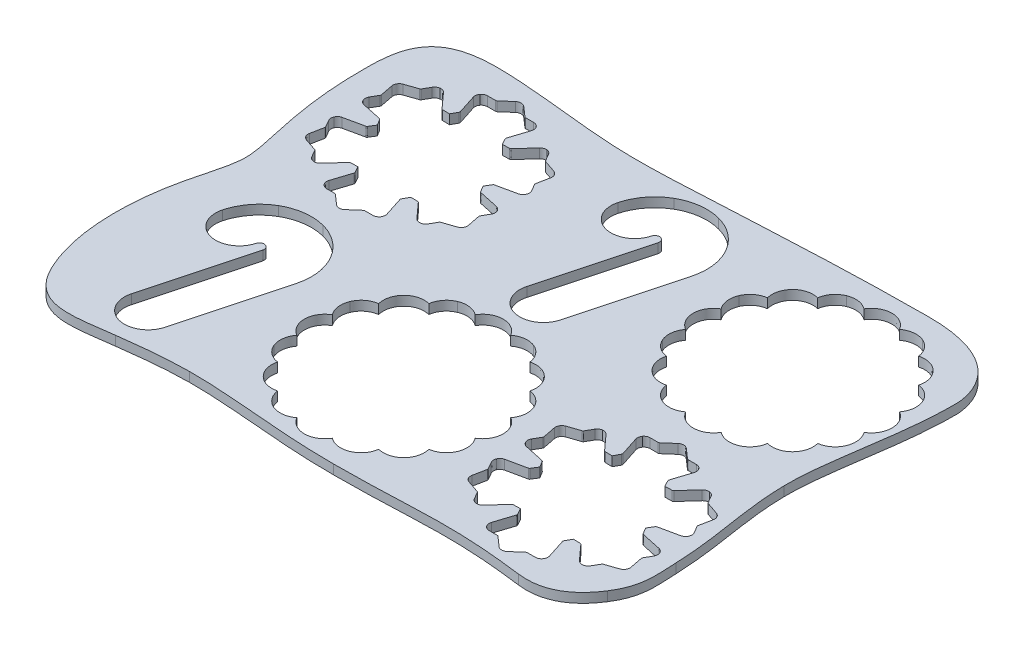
SolidWorks part; units mm, degrees
ref_plane "Front Plane" through (0, 0, 0) normal (0, 0, 1) x (1, 0, 0)
ref_plane "Top Plane" through (0, 0, 0) normal (0, 1, 0) x (1, 0, 0)
ref_plane "Right Plane" through (0, 0, 0) normal (1, 0, 0) x (0, 0, -1)
sketch "Sketch1" plane through (0, 0, 0) normal (0, 1, 0) x (1, 0, 0)
  line L100 (-5.4526, -78.2747) -> (-4.2948, -80.1766)
  line L101 (-3.9727, -80.4056) -> (2.2196, -81.7357)
  line L102 (3.5316, -84.6911) -> (2.2506, -86.9098)
  line L103 (2.1932, -87.2568) -> (2.9936, -91.3045)
  line L104 (1.6767, -93.5857) -> (-2.229, -94.9164)
  line L105 (-2.5008, -95.1396) -> (-3.7818, -97.3583)
  line L106 (-6.9972, -97.6996) -> (-11.2454, -93.0021)
  line L107 (-11.6046, -92.8376) -> (-13.8307, -92.7859)
  line L108 (-13.8307, -92.7859) -> (-14.8989, -94.7395)
  line L109 (-14.9361, -95.1329) -> (-12.9919, -101.1607)
  line L110 (-14.8953, -103.7747) -> (-17.4572, -103.7747)
  line L111 (-17.7865, -103.8984) -> (-20.8917, -106.6155)
  line L112 (-23.5257, -106.6155) -> (-26.6309, -103.8984)
  line L113 (-26.9602, -103.7747) -> (-29.5221, -103.7747)
  line L114 (-31.4255, -101.1607) -> (-29.4813, -95.1329)
  line L115 (-29.5185, -94.7395) -> (-30.5867, -92.7859)
  line L116 (-30.5867, -92.7859) -> (-32.8128, -92.8376)
  line L117 (-33.172, -93.0021) -> (-37.4202, -97.6996)
  line L118 (-40.6356, -97.3583) -> (-41.9166, -95.1396)
  line L119 (-42.1884, -94.9164) -> (-46.0941, -93.5857)
  line L120 (-47.411, -91.3045) -> (-46.6106, -87.2568)
  line L121 (-46.668, -86.9098) -> (-47.949, -84.6911)
  line L122 (-46.637, -81.7357) -> (-40.4447, -80.4056)
  line L123 (-40.1226, -80.1766) -> (-38.9648, -78.2747)
  line L124 (-38.9648, -78.2747) -> (-40.1226, -76.3728)
  line L125 (-40.4447, -76.1438) -> (-46.637, -74.8137)
  line L126 (-47.949, -71.8583) -> (-46.668, -69.6396)
  line L127 (-46.6106, -69.2926) -> (-47.411, -65.2449)
  line L128 (-46.0941, -62.9637) -> (-42.1884, -61.633)
  line L129 (-41.9166, -61.4098) -> (-40.6356, -59.1911)
  line L130 (-37.4202, -58.8498) -> (-33.172, -63.5473)
  line L131 (-32.8128, -63.7118) -> (-30.5867, -63.7635)
  line L132 (-30.5867, -63.7635) -> (-29.5185, -61.8099)
  line L133 (-29.4813, -61.4165) -> (-31.4255, -55.3887)
  line L134 (-29.5221, -52.7747) -> (-26.9602, -52.7747)
  line L135 (-26.6309, -52.651) -> (-23.5257, -49.9339)
  line L136 (-20.8917, -49.9339) -> (-17.7865, -52.651)
  line L137 (-17.4572, -52.7747) -> (-14.8953, -52.7747)
  line L138 (-12.9919, -55.3887) -> (-14.9361, -61.4165)
  line L139 (-14.8989, -61.8099) -> (-13.8307, -63.7635)
  line L140 (-13.8307, -63.7635) -> (-11.6046, -63.7118)
  line L141 (-11.2454, -63.5473) -> (-6.9972, -58.8498)
  line L142 (-3.7818, -59.1911) -> (-2.5008, -61.4098)
  line L143 (-2.229, -61.633) -> (1.6767, -62.9637)
  line L144 (2.9936, -65.2449) -> (2.1932, -69.2926)
  line L145 (2.2506, -69.6396) -> (3.5316, -71.8583)
  line L146 (2.2196, -74.8137) -> (-3.9727, -76.1438)
  line L147 (-4.2948, -76.3728) -> (-5.4526, -78.2747)
  line L148 (114.1494, -146.3616) -> (115.3072, -148.2635)
  line L149 (115.6293, -148.4925) -> (121.8216, -149.8226)
  line L150 (123.1336, -152.778) -> (121.8526, -154.9967)
  line L151 (121.7952, -155.3437) -> (122.5956, -159.3914)
  line L152 (121.2787, -161.6726) -> (117.373, -163.0033)
  line L153 (117.1012, -163.2265) -> (115.8202, -165.4452)
  line L154 (112.6048, -165.7865) -> (108.3566, -161.089)
  line L155 (107.9974, -160.9245) -> (105.7713, -160.8728)
  line L156 (105.7713, -160.8728) -> (104.7031, -162.8264)
  line L157 (104.6659, -163.2198) -> (106.6101, -169.2476)
  line L158 (104.7067, -171.8616) -> (102.1448, -171.8616)
  line L159 (101.8155, -171.9853) -> (98.7103, -174.7024)
  line L160 (96.0763, -174.7024) -> (92.9711, -171.9853)
  line L161 (92.6418, -171.8616) -> (90.0799, -171.8616)
  line L162 (88.1765, -169.2476) -> (90.1207, -163.2198)
  line L163 (90.0835, -162.8264) -> (89.0153, -160.8728)
  line L164 (89.0153, -160.8728) -> (86.7892, -160.9245)
  line L165 (86.43, -161.089) -> (82.1818, -165.7865)
  line L166 (78.9664, -165.4452) -> (77.6854, -163.2265)
  line L167 (77.4136, -163.0033) -> (73.5079, -161.6726)
  line L168 (72.191, -159.3914) -> (72.9914, -155.3437)
  line L169 (72.934, -154.9967) -> (71.653, -152.778)
  line L170 (72.965, -149.8226) -> (79.1573, -148.4925)
  line L171 (79.4794, -148.2635) -> (80.6372, -146.3616)
  line L172 (80.6372, -146.3616) -> (79.4794, -144.4597)
  line L173 (79.1573, -144.2307) -> (72.965, -142.9006)
  line L174 (71.653, -139.9452) -> (72.934, -137.7265)
  line L175 (72.9914, -137.3795) -> (72.191, -133.3318)
  line L176 (73.5079, -131.0506) -> (77.4136, -129.7199)
  line L177 (77.6854, -129.4967) -> (78.9664, -127.278)
  line L178 (82.1818, -126.9367) -> (86.43, -131.6342)
  line L179 (86.7892, -131.7987) -> (89.0153, -131.8504)
  line L180 (89.0153, -131.8504) -> (90.0835, -129.8968)
  line L181 (90.1207, -129.5034) -> (88.1765, -123.4756)
  line L182 (90.0799, -120.8616) -> (92.6418, -120.8616)
  line L183 (92.9711, -120.7379) -> (96.0763, -118.0208)
  line L184 (98.7103, -118.0208) -> (101.8155, -120.7379)
  line L185 (102.1448, -120.8616) -> (104.7067, -120.8616)
  line L186 (106.6101, -123.4756) -> (104.6659, -129.5034)
  line L187 (104.7031, -129.8968) -> (105.7713, -131.8504)
  line L188 (105.7713, -131.8504) -> (107.9974, -131.7987)
  line L189 (108.3566, -131.6342) -> (112.6048, -126.9367)
  line L190 (115.8202, -127.278) -> (117.1012, -129.4967)
  line L191 (117.373, -129.7199) -> (121.2787, -131.0506)
  line L192 (122.5956, -133.3318) -> (121.7952, -137.3795)
  line L193 (121.8526, -137.7265) -> (123.1336, -139.9452)
  line L194 (121.8216, -142.9006) -> (115.6293, -144.2307)
  line L195 (115.3072, -144.4597) -> (114.1494, -146.3616)
  line L196 (52.319, -69.9423) -> (43.5191, -102.7837)
  line L197 (29.0302, -98.9015) -> (37.83, -66.06)
  line L198 (-8.328, -134.6046) -> (-17.1279, -167.446)
  line L199 (-31.6168, -163.5638) -> (-22.817, -130.7223)
  spline S0 degree 3 poles (10.2066, -46.725) (-4.1601, -46.725) (-21.8076, -43.4442) (-36.1743, -43.4442) knots 0.933333 0.933333 0.933333 0.933333 1 1 1 1
  spline S1 degree 3 poles (100.8566, -43.5364) (61.0797, -43.6655) (27.679, -46.9673) (10.2066, -46.725) knots 0.866667 0.866667 0.866667 0.866667 0.933333 0.933333 0.933333 0.933333
  spline S2 degree 3 poles (124.4948, -112.8693) (124.2114, -99.3196) (129.2574, -80.9721) (129.2574, -63.3776) (129.2574, -61.7415) (129.2574, -43.4443) (100.8566, -43.5364) knots 0.733333 0.733333 0.733333 0.733333 0.8 0.8 0.8 0.866667 0.866667 0.866667 0.866667
  spline S3 degree 3 poles (128.5409, -151.0747) (127.8277, -135.2704) (124.7905, -127.0117) (124.4948, -112.8693) knots 0.666667 0.666667 0.666667 0.666667 0.733333 0.733333 0.733333 0.733333
  spline S4 degree 3 poles (125.3709, -169.6066) (129.4875, -163.2087) (128.8669, -158.303) (128.5409, -151.0747) knots 0.6 0.6 0.6 0.6 0.666667 0.666667 0.666667 0.666667
  spline S5 degree 3 poles (106.5724, -179.1324) (116.5716, -180.4333) (122.2318, -174.4851) (125.3709, -169.6066) knots 0.533333 0.533333 0.533333 0.533333 0.6 0.6 0.6 0.6
  spline S6 degree 3 poles (47.1667, -178.2283) (73.1303, -178.1855) (80.9016, -175.7924) (106.5724, -179.1324) knots 0.466667 0.466667 0.466667 0.466667 0.533333 0.533333 0.533333 0.533333
  spline S7 degree 3 poles (-1.0433, -175.6612) (12.98, -175.5302) (28.1615, -178.2596) (47.1667, -178.2283) knots 0.4 0.4 0.4 0.4 0.466667 0.466667 0.466667 0.466667
  spline S8 degree 3 poles (-22.7994, -177.4606) (-16.2998, -176.6473) (-9.5271, -175.7405) (-1.0433, -175.6612) knots 0.333333 0.333333 0.333333 0.333333 0.4 0.4 0.4 0.4
  spline S9 degree 3 poles (-51.6012, -168.625) (-45.3179, -182.1062) (-34.9935, -178.9865) (-22.7994, -177.4606) knots 0.266667 0.266667 0.266667 0.266667 0.333333 0.333333 0.333333 0.333333
  spline S10 degree 3 poles (-54.2266, -124.1699) (-57.4788, -138.2379) (-57.7685, -155.3929) (-51.6012, -168.625) knots 0.2 0.2 0.2 0.2 0.266667 0.266667 0.266667 0.266667
  spline S11 degree 3 poles (-50.9684, -109.4932) (-51.4044, -114.2106) (-52.7481, -117.7745) (-54.2266, -124.1699) knots 0.133333 0.133333 0.133333 0.133333 0.2 0.2 0.2 0.2
  spline S12 degree 3 poles (-56.4426, -63.5892) (-56.7369, -89.5125) (-50.1871, -101.0414) (-50.9684, -109.4932) knots 0.066667 0.066667 0.066667 0.066667 0.133333 0.133333 0.133333 0.133333
  spline S13 degree 3 poles (-36.1743, -43.4442) (-53.4737, -43.4442) (-56.3096, -51.8729) (-56.4426, -63.5892) knots 0 0 0 0 0.066667 0.066667 0.066667 0.066667
  spline S250 degree 3 poles (-4.2948, -80.1766) (-4.2771, -80.2056) (-4.2355, -80.2604) (-4.1593, -80.327) (-4.0713, -80.3772) (-4.0059, -80.3984) (-3.9727, -80.4056) knots 0.009804 0.009804 0.009804 0.009804 0.012255 0.014705 0.017156 0.019607 0.019607 0.019607 0.019607
  spline S251 degree 3 poles (2.2196, -81.7357) (2.3737, -81.7688) (2.6768, -81.873) (3.0721, -82.1251) (3.3997, -82.4604) (3.5636, -82.7357) (3.6276, -82.8797) knots 0.029412 0.029412 0.029412 0.029412 0.031863 0.034314 0.036765 0.039216 0.039216 0.039216 0.039216
  spline S252 degree 3 poles (3.6276, -82.8797) (3.6915, -83.0237) (3.7853, -83.33) (3.8138, -83.7978) (3.736, -84.2599) (3.6104, -84.5547) (3.5316, -84.6911) knots 0.039216 0.039216 0.039216 0.039216 0.041666 0.044117 0.046568 0.049019 0.049019 0.049019 0.049019
  spline S253 degree 3 poles (2.2506, -86.9098) (2.2357, -86.9357) (2.2105, -86.9903) (2.1879, -87.0777) (2.1811, -87.1677) (2.1874, -87.2275) (2.1932, -87.2568) knots 0.058824 0.058824 0.058824 0.058824 0.061275 0.063726 0.066177 0.068628 0.068628 0.068628 0.068628
  spline S254 degree 3 poles (2.9936, -91.3045) (3.0405, -91.5418) (3.0452, -92.0445) (2.7975, -92.712) (2.3434, -93.2603) (1.9056, -93.5077) (1.6767, -93.5857) knots 0.078431 0.078431 0.078431 0.078431 0.080882 0.083333 0.085784 0.088235 0.088235 0.088235 0.088235
  spline S255 degree 3 poles (-2.229, -94.9164) (-2.2574, -94.9261) (-2.3128, -94.9507) (-2.3869, -95.0013) (-2.4509, -95.0641) (-2.4858, -95.1136) (-2.5008, -95.1396) knots 0.098039 0.098039 0.098039 0.098039 0.10049 0.102941 0.105392 0.107843 0.107843 0.107843 0.107843
  spline S256 degree 3 poles (-3.7818, -97.3583) (-3.8606, -97.4948) (-4.0528, -97.7513) (-4.414, -98.0501) (-4.8337, -98.259) (-5.1462, -98.3305) (-5.3029, -98.3471) knots 0.117647 0.117647 0.117647 0.117647 0.120098 0.122549 0.125 0.127451 0.127451 0.127451 0.127451
  spline S257 degree 3 poles (-5.3029, -98.3471) (-5.4596, -98.3637) (-5.78, -98.3593) (-6.234, -98.2431) (-6.6498, -98.0269) (-6.8915, -97.8165) (-6.9972, -97.6996) knots 0.127451 0.127451 0.127451 0.127451 0.129902 0.132353 0.134804 0.137255 0.137255 0.137255 0.137255
  spline S258 degree 3 poles (-11.2454, -93.0021) (-11.2681, -92.9769) (-11.3192, -92.9309) (-11.4066, -92.8798) (-11.5025, -92.847) (-11.5707, -92.8384) (-11.6046, -92.8376) knots 0.147059 0.147059 0.147059 0.147059 0.14951 0.15196 0.154411 0.156862 0.156862 0.156862 0.156862
  spline S259 degree 3 poles (-14.8989, -94.7395) (-14.9151, -94.7693) (-14.9417, -94.8327) (-14.9613, -94.9323) (-14.9608, -95.0337) (-14.9465, -95.1007) (-14.9361, -95.1329) knots 0.176472 0.176472 0.176472 0.176472 0.178922 0.181373 0.183824 0.186274 0.186274 0.186274 0.186274
  spline S260 degree 3 poles (-12.9919, -101.1607) (-12.9436, -101.3107) (-12.8824, -101.6252) (-12.9032, -102.0933) (-13.0295, -102.5447) (-13.1857, -102.8245) (-13.2785, -102.9519) knots 0.196078 0.196078 0.196078 0.196078 0.198529 0.20098 0.203431 0.205882 0.205882 0.205882 0.205882
  spline S261 degree 3 poles (-13.2785, -102.9519) (-13.3712, -103.0793) (-13.5894, -103.3141) (-13.9801, -103.5731) (-14.4195, -103.7365) (-14.7377, -103.7747) (-14.8953, -103.7747) knots 0.205883 0.205883 0.205883 0.205883 0.208333 0.210784 0.213235 0.215686 0.215686 0.215686 0.215686
  spline S262 degree 3 poles (-17.4572, -103.7747) (-17.4872, -103.7747) (-17.5476, -103.7802) (-17.634, -103.8042) (-17.7148, -103.843) (-17.7639, -103.8786) (-17.7865, -103.8984) knots 0.22549 0.22549 0.22549 0.22549 0.227941 0.230392 0.232843 0.235294 0.235294 0.235294 0.235294
  spline S263 degree 3 poles (-20.8917, -106.6155) (-21.0737, -106.7748) (-21.5067, -107.0306) (-22.2087, -107.1501) (-22.9107, -107.0306) (-23.3437, -106.7748) (-23.5257, -106.6155) knots 0.245098 0.245098 0.245098 0.245098 0.247549 0.25 0.252451 0.254902 0.254902 0.254902 0.254902
  spline S264 degree 3 poles (-26.6309, -103.8984) (-26.6535, -103.8786) (-26.7026, -103.843) (-26.7834, -103.8042) (-26.8698, -103.7802) (-26.9302, -103.7747) (-26.9602, -103.7747) knots 0.264706 0.264706 0.264706 0.264706 0.267157 0.269608 0.272059 0.27451 0.27451 0.27451 0.27451
  spline S265 degree 3 poles (-29.5221, -103.7747) (-29.6797, -103.7747) (-29.9979, -103.7365) (-30.4373, -103.5731) (-30.828, -103.3141) (-31.0462, -103.0793) (-31.1389, -102.9519) knots 0.284314 0.284314 0.284314 0.284314 0.286765 0.289216 0.291667 0.294117 0.294117 0.294117 0.294117
  spline S266 degree 3 poles (-31.1389, -102.9519) (-31.2317, -102.8245) (-31.3879, -102.5447) (-31.5142, -102.0933) (-31.535, -101.6252) (-31.4738, -101.3107) (-31.4255, -101.1607) knots 0.294118 0.294118 0.294118 0.294118 0.296569 0.29902 0.301471 0.303922 0.303922 0.303922 0.303922
  spline S267 degree 3 poles (-29.4813, -95.1329) (-29.4709, -95.1007) (-29.4566, -95.0337) (-29.4561, -94.9323) (-29.4757, -94.8327) (-29.5023, -94.7693) (-29.5185, -94.7395) knots 0.313726 0.313726 0.313726 0.313726 0.316176 0.318627 0.321078 0.323528 0.323528 0.323528 0.323528
  spline S268 degree 3 poles (-32.8128, -92.8376) (-32.8467, -92.8384) (-32.9149, -92.847) (-33.0108, -92.8798) (-33.0982, -92.9309) (-33.1493, -92.9769) (-33.172, -93.0021) knots 0.343138 0.343138 0.343138 0.343138 0.345589 0.34804 0.35049 0.352941 0.352941 0.352941 0.352941
  spline S269 degree 3 poles (-37.4202, -97.6996) (-37.5259, -97.8165) (-37.7676, -98.0269) (-38.1834, -98.2431) (-38.6374, -98.3593) (-38.9578, -98.3637) (-39.1145, -98.3471) knots 0.362745 0.362745 0.362745 0.362745 0.365196 0.367647 0.370098 0.372549 0.372549 0.372549 0.372549
  spline S270 degree 3 poles (-39.1145, -98.3471) (-39.2712, -98.3305) (-39.5837, -98.259) (-40.0034, -98.0501) (-40.3646, -97.7513) (-40.5568, -97.4948) (-40.6356, -97.3583) knots 0.372549 0.372549 0.372549 0.372549 0.375 0.377451 0.379902 0.382353 0.382353 0.382353 0.382353
  spline S271 degree 3 poles (-41.9166, -95.1396) (-41.9316, -95.1136) (-41.9665, -95.0641) (-42.0305, -95.0013) (-42.1046, -94.9507) (-42.16, -94.9261) (-42.1884, -94.9164) knots 0.392157 0.392157 0.392157 0.392157 0.394608 0.397059 0.39951 0.401961 0.401961 0.401961 0.401961
  spline S272 degree 3 poles (-46.0941, -93.5857) (-46.323, -93.5077) (-46.7608, -93.2603) (-47.2149, -92.712) (-47.4626, -92.0445) (-47.4579, -91.5418) (-47.411, -91.3045) knots 0.411765 0.411765 0.411765 0.411765 0.414216 0.416667 0.419118 0.421569 0.421569 0.421569 0.421569
  spline S273 degree 3 poles (-46.6106, -87.2568) (-46.6048, -87.2275) (-46.5985, -87.1677) (-46.6053, -87.0777) (-46.6279, -86.9903) (-46.6531, -86.9357) (-46.668, -86.9098) knots 0.431372 0.431372 0.431372 0.431372 0.433823 0.436274 0.438725 0.441176 0.441176 0.441176 0.441176
  spline S274 degree 3 poles (-47.949, -84.6911) (-48.0278, -84.5547) (-48.1534, -84.26) (-48.2312, -83.7979) (-48.2027, -83.3302) (-48.109, -83.0239) (-48.0451, -82.8799) knots 0.45098 0.45098 0.45098 0.45098 0.453431 0.455883 0.458334 0.460785 0.460785 0.460785 0.460785
  spline S275 degree 3 poles (-48.0451, -82.8799) (-47.9812, -82.7358) (-47.8172, -82.4605) (-47.4896, -82.1251) (-47.0943, -81.873) (-46.7911, -81.7688) (-46.637, -81.7357) knots 0.460784 0.460784 0.460784 0.460784 0.463235 0.465686 0.468137 0.470588 0.470588 0.470588 0.470588
  spline S276 degree 3 poles (-40.4447, -80.4056) (-40.4115, -80.3984) (-40.3461, -80.3772) (-40.2581, -80.327) (-40.1819, -80.2604) (-40.1403, -80.2056) (-40.1226, -80.1766) knots 0.480393 0.480393 0.480393 0.480393 0.482844 0.485295 0.487745 0.490196 0.490196 0.490196 0.490196
  spline S277 degree 3 poles (-40.1226, -76.3728) (-40.1403, -76.3438) (-40.1819, -76.289) (-40.2581, -76.2224) (-40.3461, -76.1722) (-40.4115, -76.151) (-40.4447, -76.1438) knots 0.509804 0.509804 0.509804 0.509804 0.512255 0.514705 0.517156 0.519607 0.519607 0.519607 0.519607
  spline S278 degree 3 poles (-46.637, -74.8137) (-46.7911, -74.7806) (-47.0943, -74.6764) (-47.4896, -74.4243) (-47.8172, -74.0889) (-47.9812, -73.8136) (-48.0451, -73.6695) knots 0.529412 0.529412 0.529412 0.529412 0.531863 0.534314 0.536765 0.539216 0.539216 0.539216 0.539216
  spline S279 degree 3 poles (-48.0451, -73.6695) (-48.109, -73.5255) (-48.2027, -73.2192) (-48.2312, -72.7515) (-48.1534, -72.2894) (-48.0278, -71.9947) (-47.949, -71.8583) knots 0.539215 0.539215 0.539215 0.539215 0.541666 0.544117 0.546569 0.54902 0.54902 0.54902 0.54902
  spline S280 degree 3 poles (-46.668, -69.6396) (-46.6531, -69.6137) (-46.6279, -69.5591) (-46.6053, -69.4717) (-46.5985, -69.3817) (-46.6048, -69.3219) (-46.6106, -69.2926) knots 0.558824 0.558824 0.558824 0.558824 0.561275 0.563726 0.566177 0.568628 0.568628 0.568628 0.568628
  spline S281 degree 3 poles (-47.411, -65.2449) (-47.4579, -65.0076) (-47.4626, -64.5049) (-47.2149, -63.8374) (-46.7608, -63.2891) (-46.323, -63.0417) (-46.0941, -62.9637) knots 0.578431 0.578431 0.578431 0.578431 0.580882 0.583333 0.585784 0.588235 0.588235 0.588235 0.588235
  spline S282 degree 3 poles (-42.1884, -61.633) (-42.16, -61.6233) (-42.1046, -61.5987) (-42.0305, -61.5481) (-41.9665, -61.4853) (-41.9316, -61.4358) (-41.9166, -61.4098) knots 0.598039 0.598039 0.598039 0.598039 0.60049 0.602941 0.605392 0.607843 0.607843 0.607843 0.607843
  spline S283 degree 3 poles (-40.6356, -59.1911) (-40.5568, -59.0546) (-40.3646, -58.7981) (-40.0034, -58.4993) (-39.5837, -58.2904) (-39.2712, -58.2189) (-39.1145, -58.2023) knots 0.617647 0.617647 0.617647 0.617647 0.620098 0.622549 0.625 0.627451 0.627451 0.627451 0.627451
  spline S284 degree 3 poles (-39.1145, -58.2023) (-38.9578, -58.1857) (-38.6374, -58.1901) (-38.1834, -58.3063) (-37.7676, -58.5225) (-37.5259, -58.7329) (-37.4202, -58.8498) knots 0.627451 0.627451 0.627451 0.627451 0.629902 0.632353 0.634804 0.637255 0.637255 0.637255 0.637255
  spline S285 degree 3 poles (-33.172, -63.5473) (-33.1493, -63.5725) (-33.0982, -63.6185) (-33.0108, -63.6696) (-32.9149, -63.7024) (-32.8467, -63.711) (-32.8128, -63.7118) knots 0.647059 0.647059 0.647059 0.647059 0.64951 0.65196 0.654411 0.656862 0.656862 0.656862 0.656862
  spline S286 degree 3 poles (-29.5185, -61.8099) (-29.5023, -61.7801) (-29.4757, -61.7167) (-29.4561, -61.6171) (-29.4566, -61.5157) (-29.4709, -61.4487) (-29.4813, -61.4165) knots 0.676472 0.676472 0.676472 0.676472 0.678922 0.681373 0.683824 0.686274 0.686274 0.686274 0.686274
  spline S287 degree 3 poles (-31.4255, -55.3887) (-31.4738, -55.2387) (-31.535, -54.9242) (-31.5142, -54.4561) (-31.3879, -54.0047) (-31.2317, -53.7249) (-31.1389, -53.5975) knots 0.696078 0.696078 0.696078 0.696078 0.698529 0.70098 0.703431 0.705882 0.705882 0.705882 0.705882
  spline S288 degree 3 poles (-31.1389, -53.5975) (-31.0462, -53.4701) (-30.828, -53.2353) (-30.4373, -52.9763) (-29.9979, -52.8129) (-29.6797, -52.7747) (-29.5221, -52.7747) knots 0.705883 0.705883 0.705883 0.705883 0.708333 0.710784 0.713235 0.715686 0.715686 0.715686 0.715686
  spline S289 degree 3 poles (-26.9602, -52.7747) (-26.9302, -52.7747) (-26.8698, -52.7692) (-26.7834, -52.7452) (-26.7026, -52.7064) (-26.6535, -52.6708) (-26.6309, -52.651) knots 0.72549 0.72549 0.72549 0.72549 0.727941 0.730392 0.732843 0.735294 0.735294 0.735294 0.735294
  spline S290 degree 3 poles (-23.5257, -49.9339) (-23.3437, -49.7746) (-22.9107, -49.5188) (-22.2087, -49.3993) (-21.5067, -49.5188) (-21.0737, -49.7746) (-20.8917, -49.9339) knots 0.745098 0.745098 0.745098 0.745098 0.747549 0.75 0.752451 0.754902 0.754902 0.754902 0.754902
  spline S291 degree 3 poles (-17.7865, -52.651) (-17.7639, -52.6708) (-17.7148, -52.7064) (-17.634, -52.7452) (-17.5476, -52.7692) (-17.4872, -52.7747) (-17.4572, -52.7747) knots 0.764706 0.764706 0.764706 0.764706 0.767157 0.769608 0.772059 0.77451 0.77451 0.77451 0.77451
  spline S292 degree 3 poles (-14.8953, -52.7747) (-14.7377, -52.7747) (-14.4195, -52.8129) (-13.9801, -52.9763) (-13.5894, -53.2353) (-13.3712, -53.4701) (-13.2785, -53.5975) knots 0.784314 0.784314 0.784314 0.784314 0.786765 0.789216 0.791667 0.794117 0.794117 0.794117 0.794117
  spline S293 degree 3 poles (-13.2785, -53.5975) (-13.1857, -53.7249) (-13.0295, -54.0047) (-12.9032, -54.4561) (-12.8824, -54.9242) (-12.9436, -55.2387) (-12.9919, -55.3887) knots 0.794118 0.794118 0.794118 0.794118 0.796569 0.79902 0.801471 0.803922 0.803922 0.803922 0.803922
  spline S294 degree 3 poles (-14.9361, -61.4165) (-14.9465, -61.4487) (-14.9608, -61.5157) (-14.9613, -61.6171) (-14.9417, -61.7167) (-14.9151, -61.7801) (-14.8989, -61.8099) knots 0.813726 0.813726 0.813726 0.813726 0.816176 0.818627 0.821078 0.823528 0.823528 0.823528 0.823528
  spline S295 degree 3 poles (-11.6046, -63.7118) (-11.5707, -63.711) (-11.5025, -63.7024) (-11.4066, -63.6696) (-11.3192, -63.6185) (-11.2681, -63.5725) (-11.2454, -63.5473) knots 0.843138 0.843138 0.843138 0.843138 0.845589 0.84804 0.85049 0.852941 0.852941 0.852941 0.852941
  spline S296 degree 3 poles (-6.9972, -58.8498) (-6.8915, -58.7329) (-6.6498, -58.5225) (-6.234, -58.3063) (-5.78, -58.1901) (-5.4596, -58.1857) (-5.3029, -58.2023) knots 0.862745 0.862745 0.862745 0.862745 0.865196 0.867647 0.870098 0.872549 0.872549 0.872549 0.872549
  spline S297 degree 3 poles (-5.3029, -58.2023) (-5.1462, -58.2189) (-4.8337, -58.2904) (-4.414, -58.4993) (-4.0528, -58.7981) (-3.8606, -59.0546) (-3.7818, -59.1911) knots 0.872549 0.872549 0.872549 0.872549 0.875 0.877451 0.879902 0.882353 0.882353 0.882353 0.882353
  spline S298 degree 3 poles (-2.5008, -61.4098) (-2.4858, -61.4358) (-2.4509, -61.4853) (-2.3869, -61.5481) (-2.3128, -61.5987) (-2.2574, -61.6233) (-2.229, -61.633) knots 0.892157 0.892157 0.892157 0.892157 0.894608 0.897059 0.89951 0.901961 0.901961 0.901961 0.901961
  spline S299 degree 3 poles (1.6767, -62.9637) (1.9056, -63.0417) (2.3434, -63.2891) (2.7975, -63.8374) (3.0452, -64.5049) (3.0405, -65.0076) (2.9936, -65.2449) knots 0.911765 0.911765 0.911765 0.911765 0.914216 0.916667 0.919118 0.921569 0.921569 0.921569 0.921569
  spline S300 degree 3 poles (2.1932, -69.2926) (2.1874, -69.3219) (2.1811, -69.3817) (2.1879, -69.4717) (2.2105, -69.5591) (2.2357, -69.6137) (2.2506, -69.6396) knots 0.931372 0.931372 0.931372 0.931372 0.933823 0.936274 0.938725 0.941176 0.941176 0.941176 0.941176
  spline S301 degree 3 poles (3.5316, -71.8583) (3.6104, -71.9947) (3.736, -72.2894) (3.8138, -72.7515) (3.7853, -73.2192) (3.6916, -73.5255) (3.6277, -73.6695) knots 0.95098 0.95098 0.95098 0.95098 0.953431 0.955883 0.958334 0.960785 0.960785 0.960785 0.960785
  spline S302 degree 3 poles (3.6277, -73.6695) (3.5638, -73.8136) (3.3998, -74.0889) (3.0722, -74.4243) (2.6769, -74.6764) (2.3737, -74.7806) (2.2196, -74.8137) knots 0.960784 0.960784 0.960784 0.960784 0.963235 0.965686 0.968137 0.970588 0.970588 0.970588 0.970588
  spline S303 degree 3 poles (-3.9727, -76.1438) (-4.0059, -76.151) (-4.0713, -76.1722) (-4.1593, -76.2224) (-4.2355, -76.289) (-4.2771, -76.3438) (-4.2948, -76.3728) knots 0.980393 0.980393 0.980393 0.980393 0.982844 0.985295 0.987745 0.990196 0.990196 0.990196 0.990196
  spline S358 degree 3 poles (115.3072, -148.2635) (115.3249, -148.2925) (115.3665, -148.3473) (115.4427, -148.4139) (115.5307, -148.4641) (115.5961, -148.4853) (115.6293, -148.4925) knots 0.009804 0.009804 0.009804 0.009804 0.012255 0.014705 0.017156 0.019607 0.019607 0.019607 0.019607
  spline S359 degree 3 poles (121.8216, -149.8226) (121.9757, -149.8557) (122.2788, -149.9599) (122.6741, -150.212) (123.0017, -150.5473) (123.1656, -150.8226) (123.2296, -150.9666) knots 0.029412 0.029412 0.029412 0.029412 0.031863 0.034314 0.036765 0.039216 0.039216 0.039216 0.039216
  spline S360 degree 3 poles (123.2296, -150.9666) (123.2935, -151.1106) (123.3873, -151.4169) (123.4158, -151.8847) (123.338, -152.3468) (123.2124, -152.6416) (123.1336, -152.778) knots 0.039216 0.039216 0.039216 0.039216 0.041666 0.044117 0.046568 0.049019 0.049019 0.049019 0.049019
  spline S361 degree 3 poles (121.8526, -154.9967) (121.8377, -155.0226) (121.8125, -155.0772) (121.7899, -155.1646) (121.7831, -155.2546) (121.7894, -155.3144) (121.7952, -155.3437) knots 0.058824 0.058824 0.058824 0.058824 0.061275 0.063726 0.066177 0.068628 0.068628 0.068628 0.068628
  spline S362 degree 3 poles (122.5956, -159.3914) (122.6425, -159.6287) (122.6472, -160.1314) (122.3995, -160.7989) (121.9454, -161.3472) (121.5076, -161.5946) (121.2787, -161.6726) knots 0.078431 0.078431 0.078431 0.078431 0.080882 0.083333 0.085784 0.088235 0.088235 0.088235 0.088235
  spline S363 degree 3 poles (117.373, -163.0033) (117.3446, -163.013) (117.2892, -163.0376) (117.2151, -163.0882) (117.1511, -163.151) (117.1162, -163.2005) (117.1012, -163.2265) knots 0.098039 0.098039 0.098039 0.098039 0.10049 0.102941 0.105392 0.107843 0.107843 0.107843 0.107843
  spline S364 degree 3 poles (115.8202, -165.4452) (115.7414, -165.5817) (115.5492, -165.8382) (115.188, -166.137) (114.7683, -166.3459) (114.4558, -166.4174) (114.2991, -166.434) knots 0.117647 0.117647 0.117647 0.117647 0.120098 0.122549 0.125 0.127451 0.127451 0.127451 0.127451
  spline S365 degree 3 poles (114.2991, -166.434) (114.1424, -166.4506) (113.822, -166.4462) (113.368, -166.33) (112.9522, -166.1138) (112.7105, -165.9034) (112.6048, -165.7865) knots 0.127451 0.127451 0.127451 0.127451 0.129902 0.132353 0.134804 0.137255 0.137255 0.137255 0.137255
  spline S366 degree 3 poles (108.3566, -161.089) (108.3339, -161.0638) (108.2828, -161.0178) (108.1954, -160.9667) (108.0995, -160.9339) (108.0313, -160.9253) (107.9974, -160.9245) knots 0.147059 0.147059 0.147059 0.147059 0.14951 0.15196 0.154411 0.156862 0.156862 0.156862 0.156862
  spline S367 degree 3 poles (104.7031, -162.8264) (104.6869, -162.8562) (104.6603, -162.9196) (104.6407, -163.0192) (104.6412, -163.1206) (104.6555, -163.1876) (104.6659, -163.2198) knots 0.176472 0.176472 0.176472 0.176472 0.178922 0.181373 0.183824 0.186274 0.186274 0.186274 0.186274
  spline S368 degree 3 poles (106.6101, -169.2476) (106.6584, -169.3976) (106.7196, -169.7121) (106.6988, -170.1802) (106.5725, -170.6316) (106.4163, -170.9114) (106.3235, -171.0388) knots 0.196078 0.196078 0.196078 0.196078 0.198529 0.20098 0.203431 0.205882 0.205882 0.205882 0.205882
  spline S369 degree 3 poles (106.3235, -171.0388) (106.2308, -171.1662) (106.0126, -171.401) (105.6219, -171.66) (105.1825, -171.8234) (104.8643, -171.8616) (104.7067, -171.8616) knots 0.205883 0.205883 0.205883 0.205883 0.208333 0.210784 0.213235 0.215686 0.215686 0.215686 0.215686
  spline S370 degree 3 poles (102.1448, -171.8616) (102.1148, -171.8616) (102.0544, -171.8671) (101.968, -171.8911) (101.8872, -171.9299) (101.8381, -171.9655) (101.8155, -171.9853) knots 0.22549 0.22549 0.22549 0.22549 0.227941 0.230392 0.232843 0.235294 0.235294 0.235294 0.235294
  spline S371 degree 3 poles (98.7103, -174.7024) (98.5283, -174.8617) (98.0953, -175.1175) (97.3933, -175.237) (96.6913, -175.1175) (96.2583, -174.8617) (96.0763, -174.7024) knots 0.245098 0.245098 0.245098 0.245098 0.247549 0.25 0.252451 0.254902 0.254902 0.254902 0.254902
  spline S372 degree 3 poles (92.9711, -171.9853) (92.9485, -171.9655) (92.8994, -171.9299) (92.8186, -171.8911) (92.7322, -171.8671) (92.6718, -171.8616) (92.6418, -171.8616) knots 0.264706 0.264706 0.264706 0.264706 0.267157 0.269608 0.272059 0.27451 0.27451 0.27451 0.27451
  spline S373 degree 3 poles (90.0799, -171.8616) (89.9223, -171.8616) (89.6041, -171.8234) (89.1647, -171.66) (88.774, -171.401) (88.5558, -171.1662) (88.4631, -171.0388) knots 0.284314 0.284314 0.284314 0.284314 0.286765 0.289216 0.291667 0.294117 0.294117 0.294117 0.294117
  spline S374 degree 3 poles (88.4631, -171.0388) (88.3703, -170.9114) (88.2141, -170.6316) (88.0878, -170.1802) (88.067, -169.7121) (88.1282, -169.3976) (88.1765, -169.2476) knots 0.294118 0.294118 0.294118 0.294118 0.296569 0.29902 0.301471 0.303922 0.303922 0.303922 0.303922
  spline S375 degree 3 poles (90.1207, -163.2198) (90.1311, -163.1876) (90.1454, -163.1206) (90.1459, -163.0192) (90.1263, -162.9196) (90.0997, -162.8562) (90.0835, -162.8264) knots 0.313726 0.313726 0.313726 0.313726 0.316176 0.318627 0.321078 0.323528 0.323528 0.323528 0.323528
  spline S376 degree 3 poles (86.7892, -160.9245) (86.7553, -160.9253) (86.6871, -160.9339) (86.5912, -160.9667) (86.5038, -161.0178) (86.4527, -161.0638) (86.43, -161.089) knots 0.343138 0.343138 0.343138 0.343138 0.345589 0.34804 0.35049 0.352941 0.352941 0.352941 0.352941
  spline S377 degree 3 poles (82.1818, -165.7865) (82.0761, -165.9034) (81.8344, -166.1138) (81.4186, -166.33) (80.9646, -166.4462) (80.6442, -166.4506) (80.4875, -166.434) knots 0.362745 0.362745 0.362745 0.362745 0.365196 0.367647 0.370098 0.372549 0.372549 0.372549 0.372549
  spline S378 degree 3 poles (80.4875, -166.434) (80.3308, -166.4174) (80.0183, -166.3459) (79.5986, -166.137) (79.2374, -165.8382) (79.0452, -165.5817) (78.9664, -165.4452) knots 0.372549 0.372549 0.372549 0.372549 0.375 0.377451 0.379902 0.382353 0.382353 0.382353 0.382353
  spline S379 degree 3 poles (77.6854, -163.2265) (77.6704, -163.2005) (77.6355, -163.151) (77.5715, -163.0882) (77.4974, -163.0376) (77.442, -163.013) (77.4136, -163.0033) knots 0.392157 0.392157 0.392157 0.392157 0.394608 0.397059 0.39951 0.401961 0.401961 0.401961 0.401961
  spline S380 degree 3 poles (73.5079, -161.6726) (73.279, -161.5946) (72.8412, -161.3472) (72.3871, -160.7989) (72.1394, -160.1314) (72.1441, -159.6287) (72.191, -159.3914) knots 0.411765 0.411765 0.411765 0.411765 0.414216 0.416667 0.419118 0.421569 0.421569 0.421569 0.421569
  spline S381 degree 3 poles (72.9914, -155.3437) (72.9972, -155.3144) (73.0035, -155.2546) (72.9967, -155.1646) (72.9741, -155.0772) (72.9489, -155.0226) (72.934, -154.9967) knots 0.431372 0.431372 0.431372 0.431372 0.433823 0.436274 0.438725 0.441176 0.441176 0.441176 0.441176
  spline S382 degree 3 poles (71.653, -152.778) (71.5742, -152.6416) (71.4486, -152.3469) (71.3708, -151.8848) (71.3993, -151.4171) (71.493, -151.1108) (71.5569, -150.9668) knots 0.45098 0.45098 0.45098 0.45098 0.453431 0.455883 0.458334 0.460785 0.460785 0.460785 0.460785
  spline S383 degree 3 poles (71.5569, -150.9668) (71.6208, -150.8227) (71.7848, -150.5474) (72.1124, -150.212) (72.5077, -149.9599) (72.8109, -149.8557) (72.965, -149.8226) knots 0.460784 0.460784 0.460784 0.460784 0.463235 0.465686 0.468137 0.470588 0.470588 0.470588 0.470588
  spline S384 degree 3 poles (79.1573, -148.4925) (79.1905, -148.4853) (79.2559, -148.4641) (79.3439, -148.4139) (79.4201, -148.3473) (79.4617, -148.2925) (79.4794, -148.2635) knots 0.480393 0.480393 0.480393 0.480393 0.482844 0.485295 0.487745 0.490196 0.490196 0.490196 0.490196
  spline S385 degree 3 poles (79.4794, -144.4597) (79.4617, -144.4307) (79.4201, -144.3759) (79.3439, -144.3093) (79.2559, -144.2591) (79.1905, -144.2379) (79.1573, -144.2307) knots 0.509804 0.509804 0.509804 0.509804 0.512255 0.514705 0.517156 0.519607 0.519607 0.519607 0.519607
  spline S386 degree 3 poles (72.965, -142.9006) (72.8109, -142.8675) (72.5077, -142.7633) (72.1124, -142.5112) (71.7848, -142.1758) (71.6208, -141.9005) (71.5569, -141.7564) knots 0.529412 0.529412 0.529412 0.529412 0.531863 0.534314 0.536765 0.539216 0.539216 0.539216 0.539216
  spline S387 degree 3 poles (71.5569, -141.7564) (71.493, -141.6124) (71.3993, -141.3061) (71.3708, -140.8384) (71.4486, -140.3763) (71.5742, -140.0816) (71.653, -139.9452) knots 0.539215 0.539215 0.539215 0.539215 0.541666 0.544117 0.546569 0.54902 0.54902 0.54902 0.54902
  spline S388 degree 3 poles (72.934, -137.7265) (72.9489, -137.7006) (72.9741, -137.646) (72.9967, -137.5586) (73.0035, -137.4686) (72.9972, -137.4088) (72.9914, -137.3795) knots 0.558824 0.558824 0.558824 0.558824 0.561275 0.563726 0.566177 0.568628 0.568628 0.568628 0.568628
  spline S389 degree 3 poles (72.191, -133.3318) (72.1441, -133.0945) (72.1394, -132.5918) (72.3871, -131.9243) (72.8412, -131.376) (73.279, -131.1286) (73.5079, -131.0506) knots 0.578431 0.578431 0.578431 0.578431 0.580882 0.583333 0.585784 0.588235 0.588235 0.588235 0.588235
  spline S390 degree 3 poles (77.4136, -129.7199) (77.442, -129.7102) (77.4974, -129.6856) (77.5715, -129.635) (77.6355, -129.5722) (77.6704, -129.5227) (77.6854, -129.4967) knots 0.598039 0.598039 0.598039 0.598039 0.60049 0.602941 0.605392 0.607843 0.607843 0.607843 0.607843
  spline S391 degree 3 poles (78.9664, -127.278) (79.0452, -127.1415) (79.2374, -126.885) (79.5986, -126.5862) (80.0183, -126.3773) (80.3308, -126.3058) (80.4875, -126.2892) knots 0.617647 0.617647 0.617647 0.617647 0.620098 0.622549 0.625 0.627451 0.627451 0.627451 0.627451
  spline S392 degree 3 poles (80.4875, -126.2892) (80.6442, -126.2726) (80.9646, -126.277) (81.4186, -126.3932) (81.8344, -126.6094) (82.0761, -126.8198) (82.1818, -126.9367) knots 0.627451 0.627451 0.627451 0.627451 0.629902 0.632353 0.634804 0.637255 0.637255 0.637255 0.637255
  spline S393 degree 3 poles (86.43, -131.6342) (86.4527, -131.6594) (86.5038, -131.7054) (86.5912, -131.7565) (86.6871, -131.7893) (86.7553, -131.7979) (86.7892, -131.7987) knots 0.647059 0.647059 0.647059 0.647059 0.64951 0.65196 0.654411 0.656862 0.656862 0.656862 0.656862
  spline S394 degree 3 poles (90.0835, -129.8968) (90.0997, -129.867) (90.1263, -129.8036) (90.1459, -129.704) (90.1454, -129.6026) (90.1311, -129.5356) (90.1207, -129.5034) knots 0.676472 0.676472 0.676472 0.676472 0.678922 0.681373 0.683824 0.686274 0.686274 0.686274 0.686274
  spline S395 degree 3 poles (88.1765, -123.4756) (88.1282, -123.3256) (88.067, -123.0111) (88.0878, -122.543) (88.2141, -122.0916) (88.3703, -121.8118) (88.4631, -121.6844) knots 0.696078 0.696078 0.696078 0.696078 0.698529 0.70098 0.703431 0.705882 0.705882 0.705882 0.705882
  spline S396 degree 3 poles (88.4631, -121.6844) (88.5558, -121.557) (88.774, -121.3222) (89.1647, -121.0632) (89.6041, -120.8998) (89.9223, -120.8616) (90.0799, -120.8616) knots 0.705883 0.705883 0.705883 0.705883 0.708333 0.710784 0.713235 0.715686 0.715686 0.715686 0.715686
  spline S397 degree 3 poles (92.6418, -120.8616) (92.6718, -120.8616) (92.7322, -120.8561) (92.8186, -120.8321) (92.8994, -120.7933) (92.9485, -120.7577) (92.9711, -120.7379) knots 0.72549 0.72549 0.72549 0.72549 0.727941 0.730392 0.732843 0.735294 0.735294 0.735294 0.735294
  spline S398 degree 3 poles (96.0763, -118.0208) (96.2583, -117.8615) (96.6913, -117.6057) (97.3933, -117.4862) (98.0953, -117.6057) (98.5283, -117.8615) (98.7103, -118.0208) knots 0.745098 0.745098 0.745098 0.745098 0.747549 0.75 0.752451 0.754902 0.754902 0.754902 0.754902
  spline S399 degree 3 poles (101.8155, -120.7379) (101.8381, -120.7577) (101.8872, -120.7933) (101.968, -120.8321) (102.0544, -120.8561) (102.1148, -120.8616) (102.1448, -120.8616) knots 0.764706 0.764706 0.764706 0.764706 0.767157 0.769608 0.772059 0.77451 0.77451 0.77451 0.77451
  spline S400 degree 3 poles (104.7067, -120.8616) (104.8643, -120.8616) (105.1825, -120.8998) (105.6219, -121.0632) (106.0126, -121.3222) (106.2308, -121.557) (106.3235, -121.6844) knots 0.784314 0.784314 0.784314 0.784314 0.786765 0.789216 0.791667 0.794117 0.794117 0.794117 0.794117
  spline S401 degree 3 poles (106.3235, -121.6844) (106.4163, -121.8118) (106.5725, -122.0916) (106.6988, -122.543) (106.7196, -123.0111) (106.6584, -123.3256) (106.6101, -123.4756) knots 0.794118 0.794118 0.794118 0.794118 0.796569 0.79902 0.801471 0.803922 0.803922 0.803922 0.803922
  spline S402 degree 3 poles (104.6659, -129.5034) (104.6555, -129.5356) (104.6412, -129.6026) (104.6407, -129.704) (104.6603, -129.8036) (104.6869, -129.867) (104.7031, -129.8968) knots 0.813726 0.813726 0.813726 0.813726 0.816176 0.818627 0.821078 0.823528 0.823528 0.823528 0.823528
  spline S403 degree 3 poles (107.9974, -131.7987) (108.0313, -131.7979) (108.0995, -131.7893) (108.1954, -131.7565) (108.2828, -131.7054) (108.3339, -131.6594) (108.3566, -131.6342) knots 0.843138 0.843138 0.843138 0.843138 0.845589 0.84804 0.85049 0.852941 0.852941 0.852941 0.852941
  spline S404 degree 3 poles (112.6048, -126.9367) (112.7105, -126.8198) (112.9522, -126.6094) (113.368, -126.3932) (113.822, -126.277) (114.1424, -126.2726) (114.2991, -126.2892) knots 0.862745 0.862745 0.862745 0.862745 0.865196 0.867647 0.870098 0.872549 0.872549 0.872549 0.872549
  spline S405 degree 3 poles (114.2991, -126.2892) (114.4558, -126.3058) (114.7683, -126.3773) (115.188, -126.5862) (115.5492, -126.885) (115.7414, -127.1415) (115.8202, -127.278) knots 0.872549 0.872549 0.872549 0.872549 0.875 0.877451 0.879902 0.882353 0.882353 0.882353 0.882353
  spline S406 degree 3 poles (117.1012, -129.4967) (117.1162, -129.5227) (117.1511, -129.5722) (117.2151, -129.635) (117.2892, -129.6856) (117.3446, -129.7102) (117.373, -129.7199) knots 0.892157 0.892157 0.892157 0.892157 0.894608 0.897059 0.89951 0.901961 0.901961 0.901961 0.901961
  spline S407 degree 3 poles (121.2787, -131.0506) (121.5076, -131.1286) (121.9454, -131.376) (122.3995, -131.9243) (122.6472, -132.5918) (122.6425, -133.0945) (122.5956, -133.3318) knots 0.911765 0.911765 0.911765 0.911765 0.914216 0.916667 0.919118 0.921569 0.921569 0.921569 0.921569
  spline S408 degree 3 poles (121.7952, -137.3795) (121.7894, -137.4088) (121.7831, -137.4686) (121.7899, -137.5586) (121.8125, -137.646) (121.8377, -137.7006) (121.8526, -137.7265) knots 0.931372 0.931372 0.931372 0.931372 0.933823 0.936274 0.938725 0.941176 0.941176 0.941176 0.941176
  spline S409 degree 3 poles (123.1336, -139.9452) (123.2124, -140.0816) (123.338, -140.3763) (123.4158, -140.8384) (123.3873, -141.3061) (123.2936, -141.6124) (123.2297, -141.7564) knots 0.95098 0.95098 0.95098 0.95098 0.953431 0.955883 0.958334 0.960785 0.960785 0.960785 0.960785
  spline S410 degree 3 poles (123.2297, -141.7564) (123.1658, -141.9005) (123.0018, -142.1758) (122.6742, -142.5112) (122.2789, -142.7633) (121.9757, -142.8675) (121.8216, -142.9006) knots 0.960784 0.960784 0.960784 0.960784 0.963235 0.965686 0.968137 0.970588 0.970588 0.970588 0.970588
  spline S411 degree 3 poles (115.6293, -144.2307) (115.5961, -144.2379) (115.5307, -144.2591) (115.4427, -144.3093) (115.3665, -144.3759) (115.3249, -144.4307) (115.3072, -144.4597) knots 0.980393 0.980393 0.980393 0.980393 0.982844 0.985295 0.987745 0.990196 0.990196 0.990196 0.990196
  spline S424 degree 3 poles (43.5191, -102.7837) (43.3488, -103.4193) (42.8319, -104.6593) (41.6361, -106.2041) (40.0914, -107.3999) (38.8514, -107.9168) (38.2158, -108.0871) knots 0.214286 0.214286 0.214286 0.214286 0.232143 0.25 0.267857 0.285714 0.285714 0.285714 0.285714
  spline S425 degree 3 poles (38.2158, -108.0871) (37.5812, -108.2571) (36.2519, -108.4272) (34.3133, -108.1623) (32.5021, -107.4224) (31.4359, -106.6105) (30.9713, -106.146) knots 0.285714 0.285714 0.285714 0.285714 0.303571 0.321429 0.339286 0.357143 0.357143 0.357143 0.357143
  spline S426 degree 3 poles (30.9713, -106.146) (30.5068, -105.6814) (29.6949, -104.6152) (28.9549, -102.804) (28.6901, -100.8654) (28.8602, -99.5361) (29.0302, -98.9015) knots 0.357143 0.357143 0.357143 0.357143 0.375 0.392857 0.410714 0.428571 0.428571 0.428571 0.428571
  spline S427 degree 3 poles (37.83, -66.06) (37.8812, -65.8691) (37.9052, -65.4573) (37.7085, -64.9054) (37.3289, -64.4591) (36.9603, -64.274) (36.7694, -64.2229) knots 0.5 0.5 0.5 0.5 0.517857 0.535714 0.553571 0.571428 0.571428 0.571428 0.571428
  spline S428 degree 3 poles (36.7694, -64.2229) (36.5785, -64.1717) (36.1667, -64.1477) (35.6148, -64.3444) (35.1685, -64.724) (34.9834, -65.0926) (34.9323, -65.2835) knots 0.571429 0.571429 0.571429 0.571429 0.589286 0.607143 0.625 0.642857 0.642857 0.642857 0.642857
  spline S429 degree 3 poles (34.9323, -65.2835) (34.762, -65.9191) (34.2451, -67.1591) (33.0493, -68.7039) (31.5045, -69.8997) (30.2645, -70.4166) (29.6289, -70.5869) knots 0.642857 0.642857 0.642857 0.642857 0.660714 0.678571 0.696429 0.714286 0.714286 0.714286 0.714286
  spline S430 degree 3 poles (29.6289, -70.5869) (28.9943, -70.7569) (27.6651, -70.9269) (25.7265, -70.6621) (23.9153, -69.9221) (22.8491, -69.1102) (22.3846, -68.6457) knots 0.714286 0.714286 0.714286 0.714286 0.732143 0.75 0.767857 0.785714 0.785714 0.785714 0.785714
  spline S431 degree 3 poles (22.3846, -68.6457) (21.92, -68.1811) (21.1081, -67.1149) (20.3681, -65.3037) (20.1033, -63.3651) (20.2734, -62.0358) (20.4434, -61.4012) knots 0.785714 0.785714 0.785714 0.785714 0.803571 0.821429 0.839286 0.857143 0.857143 0.857143 0.857143
  spline S432 degree 3 poles (20.4434, -61.4012) (20.7242, -60.3536) (21.4982, -58.2982) (23.2055, -55.5616) (25.407, -53.2042) (27.1917, -51.9247) (28.1309, -51.3825) knots 0.857143 0.857143 0.857143 0.857143 0.875 0.892857 0.910714 0.928571 0.928571 0.928571 0.928571
  spline S433 degree 3 poles (28.1309, -51.3825) (29.0698, -50.8404) (31.0694, -49.9354) (34.2132, -49.2075) (37.4385, -49.0968) (39.6044, -49.4534) (40.6517, -49.734) knots 0.928571 0.928571 0.928571 0.928571 0.946429 0.964286 0.982143 1 1 1 1
  spline S434 degree 3 poles (40.6517, -49.734) (41.6993, -50.0147) (43.7548, -50.7888) (46.4914, -52.4962) (48.8488, -54.6976) (50.1283, -56.4825) (50.6705, -57.4217) knots 0 0 0 0 0.017857 0.035714 0.053571 0.071429 0.071429 0.071429 0.071429
  spline S435 degree 3 poles (50.6705, -57.4217) (51.2126, -58.3606) (52.1176, -60.3601) (52.8455, -63.5039) (52.9562, -66.7291) (52.5996, -68.895) (52.319, -69.9423) knots 0.071429 0.071429 0.071429 0.071429 0.089286 0.107143 0.125 0.142857 0.142857 0.142857 0.142857
  spline S448 degree 3 poles (-17.1279, -167.446) (-17.2982, -168.0816) (-17.8151, -169.3216) (-19.0109, -170.8664) (-20.5556, -172.0622) (-21.7956, -172.5791) (-22.4312, -172.7494) knots 0.214286 0.214286 0.214286 0.214286 0.232143 0.25 0.267857 0.285714 0.285714 0.285714 0.285714
  spline S449 degree 3 poles (-22.4312, -172.7494) (-23.0658, -172.9194) (-24.3951, -173.0895) (-26.3337, -172.8246) (-28.1449, -172.0847) (-29.2111, -171.2728) (-29.6757, -170.8083) knots 0.285714 0.285714 0.285714 0.285714 0.303571 0.321429 0.339286 0.357143 0.357143 0.357143 0.357143
  spline S450 degree 3 poles (-29.6757, -170.8083) (-30.1402, -170.3437) (-30.9521, -169.2775) (-31.6921, -167.4663) (-31.9569, -165.5277) (-31.7868, -164.1984) (-31.6168, -163.5638) knots 0.357143 0.357143 0.357143 0.357143 0.375 0.392857 0.410714 0.428571 0.428571 0.428571 0.428571
  spline S451 degree 3 poles (-22.817, -130.7223) (-22.7658, -130.5314) (-22.7418, -130.1196) (-22.9385, -129.5677) (-23.3181, -129.1214) (-23.6867, -128.9363) (-23.8776, -128.8852) knots 0.5 0.5 0.5 0.5 0.517857 0.535714 0.553571 0.571428 0.571428 0.571428 0.571428
  spline S452 degree 3 poles (-23.8776, -128.8852) (-24.0685, -128.834) (-24.4803, -128.81) (-25.0322, -129.0067) (-25.4785, -129.3863) (-25.6636, -129.7549) (-25.7147, -129.9458) knots 0.571429 0.571429 0.571429 0.571429 0.589286 0.607143 0.625 0.642857 0.642857 0.642857 0.642857
  spline S453 degree 3 poles (-25.7147, -129.9458) (-25.885, -130.5814) (-26.4019, -131.8214) (-27.5977, -133.3662) (-29.1425, -134.562) (-30.3825, -135.0789) (-31.0181, -135.2492) knots 0.642857 0.642857 0.642857 0.642857 0.660714 0.678571 0.696429 0.714286 0.714286 0.714286 0.714286
  spline S454 degree 3 poles (-31.0181, -135.2492) (-31.6527, -135.4192) (-32.9819, -135.5892) (-34.9205, -135.3244) (-36.7317, -134.5844) (-37.7979, -133.7725) (-38.2624, -133.308) knots 0.714286 0.714286 0.714286 0.714286 0.732143 0.75 0.767857 0.785714 0.785714 0.785714 0.785714
  spline S455 degree 3 poles (-38.2624, -133.308) (-38.727, -132.8434) (-39.5389, -131.7772) (-40.2789, -129.966) (-40.5437, -128.0274) (-40.3736, -126.6981) (-40.2036, -126.0635) knots 0.785714 0.785714 0.785714 0.785714 0.803571 0.821429 0.839286 0.857143 0.857143 0.857143 0.857143
  spline S456 degree 3 poles (-40.2036, -126.0635) (-39.9228, -125.0159) (-39.1488, -122.9605) (-37.4415, -120.2239) (-35.24, -117.8665) (-33.4553, -116.587) (-32.5161, -116.0448) knots 0.857143 0.857143 0.857143 0.857143 0.875 0.892857 0.910714 0.928571 0.928571 0.928571 0.928571
  spline S457 degree 3 poles (-32.5161, -116.0448) (-31.5772, -115.5027) (-29.5776, -114.5977) (-26.4338, -113.8698) (-23.2085, -113.7591) (-21.0426, -114.1157) (-19.9953, -114.3963) knots 0.928571 0.928571 0.928571 0.928571 0.946429 0.964286 0.982143 1 1 1 1
  spline S458 degree 3 poles (-19.9953, -114.3963) (-18.9477, -114.677) (-16.8922, -115.4511) (-14.1556, -117.1585) (-11.7982, -119.3599) (-10.5187, -121.1448) (-9.9765, -122.084) knots 0 0 0 0 0.017857 0.035714 0.053571 0.071429 0.071429 0.071429 0.071429
  spline S459 degree 3 poles (-9.9765, -122.084) (-9.4344, -123.0229) (-8.5294, -125.0224) (-7.8015, -128.1662) (-7.6908, -131.3914) (-8.0474, -133.5573) (-8.328, -134.6046) knots 0.071429 0.071429 0.071429 0.071429 0.089286 0.107143 0.125 0.142857 0.142857 0.142857 0.142857
  spline S495 degree 3 poles (110.2503, -55.9116) (110.7976, -55.7662) (111.9424, -55.6198) (113.6153, -55.8463) (115.1815, -56.4851) (116.1104, -57.1937) (116.5146, -57.5978) knots 0.971437 0.971437 0.971437 0.971437 0.978578 0.985719 0.992859 1 1 1 1
  spline S496 degree 3 poles (116.5146, -57.5978) (116.9187, -58.002) (117.6273, -58.9309) (118.2661, -60.4971) (118.4927, -62.17) (118.3462, -63.3148) (118.2009, -63.8621) knots 0 0 0 0 0.007141 0.014281 0.021422 0.028563 0.028563 0.028563 0.028563
  spline S497 degree 3 poles (118.2009, -63.8621) (118.7621, -63.9371) (119.8761, -64.2398) (121.3348, -65.0892) (122.5371, -66.2786) (123.1242, -67.289) (123.3429, -67.8172) knots 0.033937 0.033937 0.033937 0.033937 0.041078 0.048218 0.055359 0.0625 0.0625 0.0625 0.0625
  spline S498 degree 3 poles (123.3429, -67.8172) (123.5613, -68.3443) (123.8582, -69.4713) (123.8477, -71.1641) (123.4171, -72.7985) (122.8462, -73.7997) (122.5033, -74.2497) knots 0.0625 0.0625 0.0625 0.0625 0.069639 0.076778 0.083917 0.091056 0.091056 0.091056 0.091056
  spline S499 degree 3 poles (122.5033, -74.2497) (122.9931, -74.5338) (123.9065, -75.2399) (124.9293, -76.5822) (125.585, -78.1438) (125.8186, -79.8717) (125.585, -81.5996) (124.9293, -83.1612) (123.9065, -84.5036) (122.9931, -85.2097) (122.5033, -85.4938) knots 0.096435 0.096435 0.096435 0.096435 0.103576 0.110718 0.117859 0.125 0.132141 0.139282 0.146424 0.153565 0.153565 0.153565 0.153565
  spline S500 degree 3 poles (122.5033, -85.4938) (122.8463, -85.9438) (123.4171, -86.9449) (123.8477, -88.5794) (123.8582, -90.2722) (123.5613, -91.3991) (123.3429, -91.9262) knots 0.158944 0.158944 0.158944 0.158944 0.166083 0.173222 0.180361 0.1875 0.1875 0.1875 0.1875
  spline S501 degree 3 poles (123.3429, -91.9262) (123.1241, -92.4544) (122.5371, -93.4648) (121.3348, -94.6542) (119.876, -95.5036) (118.7621, -95.8063) (118.2008, -95.8813) knots 0.1875 0.1875 0.1875 0.1875 0.194641 0.201782 0.208922 0.216063 0.216063 0.216063 0.216063
  spline S502 degree 3 poles (118.2008, -95.8813) (118.3462, -96.4286) (118.4925, -97.5735) (118.2664, -99.246) (117.6259, -100.8139) (116.5696, -102.2006) (115.1829, -103.2569) (113.615, -103.8974) (111.9425, -104.1235) (110.7976, -103.9772) (110.2503, -103.8318) knots 0.221437 0.221437 0.221437 0.221437 0.228578 0.235719 0.242859 0.25 0.257141 0.264281 0.271422 0.278563 0.278563 0.278563 0.278563
  spline S503 degree 3 poles (110.2503, -103.8318) (110.1753, -104.3931) (109.8726, -105.507) (109.0232, -106.9658) (107.8338, -108.1681) (106.8234, -108.7552) (106.2952, -108.9739) knots 0.283937 0.283937 0.283937 0.283937 0.291078 0.298218 0.305359 0.3125 0.3125 0.3125 0.3125
  spline S504 degree 3 poles (106.2952, -108.9739) (105.7681, -109.1923) (104.6411, -109.4892) (102.9483, -109.4787) (101.3139, -109.0481) (100.3127, -108.4772) (99.8627, -108.1343) knots 0.3125 0.3125 0.3125 0.3125 0.319639 0.326778 0.333917 0.341056 0.341056 0.341056 0.341056
  spline S505 degree 3 poles (99.8627, -108.1343) (99.5786, -108.6241) (98.8726, -109.5375) (97.5302, -110.5603) (95.9686, -111.216) (94.2407, -111.4496) (92.5128, -111.216) (90.9512, -110.5603) (89.6089, -109.5375) (88.9028, -108.6241) (88.6187, -108.1342) knots 0.346435 0.346435 0.346435 0.346435 0.353576 0.360718 0.367859 0.375 0.382141 0.389282 0.396424 0.403565 0.403565 0.403565 0.403565
  spline S506 degree 3 poles (88.6187, -108.1342) (88.1687, -108.4772) (87.1675, -109.0481) (85.5331, -109.4787) (83.8403, -109.4892) (82.7133, -109.1923) (82.1862, -108.9739) knots 0.408944 0.408944 0.408944 0.408944 0.416083 0.423222 0.430361 0.4375 0.4375 0.4375 0.4375
  spline S507 degree 3 poles (82.1862, -108.9739) (81.658, -108.7552) (80.6476, -108.1681) (79.4582, -106.9658) (78.6088, -105.507) (78.3061, -104.3931) (78.2311, -103.8318) knots 0.4375 0.4375 0.4375 0.4375 0.444641 0.451782 0.458922 0.466063 0.466063 0.466063 0.466063
  spline S508 degree 3 poles (78.2311, -103.8318) (77.6838, -103.9772) (76.5389, -104.1235) (74.8664, -103.8974) (73.2985, -103.2569) (71.9118, -102.2006) (70.8555, -100.8139) (70.215, -99.246) (69.9889, -97.5735) (70.1352, -96.4286) (70.2806, -95.8813) knots 0.471437 0.471437 0.471437 0.471437 0.478578 0.485719 0.492859 0.5 0.507141 0.514281 0.521422 0.528563 0.528563 0.528563 0.528563
  spline S509 degree 3 poles (70.2806, -95.8813) (69.7193, -95.8063) (68.6054, -95.5036) (67.1466, -94.6542) (65.9443, -93.4648) (65.3572, -92.4544) (65.1385, -91.9262) knots 0.533937 0.533937 0.533937 0.533937 0.541078 0.548218 0.555359 0.5625 0.5625 0.5625 0.5625
  spline S510 degree 3 poles (65.1385, -91.9262) (64.9201, -91.3991) (64.6232, -90.2721) (64.6337, -88.5793) (65.0643, -86.9449) (65.6352, -85.9437) (65.9781, -85.4937) knots 0.5625 0.5625 0.5625 0.5625 0.569639 0.576778 0.583917 0.591056 0.591056 0.591056 0.591056
  spline S511 degree 3 poles (65.9781, -85.4937) (65.4883, -85.2096) (64.5749, -84.5036) (63.5521, -83.1612) (62.8964, -81.5996) (62.6628, -79.8717) (62.8964, -78.1438) (63.5521, -76.5822) (64.5749, -75.2399) (65.4883, -74.5338) (65.9782, -74.2497) knots 0.596435 0.596435 0.596435 0.596435 0.603576 0.610718 0.617859 0.625 0.632141 0.639282 0.646424 0.653565 0.653565 0.653565 0.653565
  spline S512 degree 3 poles (65.9782, -74.2497) (65.6352, -73.7997) (65.0643, -72.7985) (64.6337, -71.1641) (64.6232, -69.4713) (64.9201, -68.3443) (65.1385, -67.8172) knots 0.658944 0.658944 0.658944 0.658944 0.666083 0.673222 0.680361 0.6875 0.6875 0.6875 0.6875
  spline S513 degree 3 poles (65.1385, -67.8172) (65.3572, -67.289) (65.9443, -66.2786) (67.1466, -65.0892) (68.6054, -64.2398) (69.7193, -63.9371) (70.2806, -63.8621) knots 0.6875 0.6875 0.6875 0.6875 0.694641 0.701782 0.708922 0.716063 0.716063 0.716063 0.716063
  spline S514 degree 3 poles (70.2806, -63.8621) (70.1352, -63.3148) (69.9889, -62.1699) (70.215, -60.4974) (70.8555, -58.9295) (71.9118, -57.5428) (73.2985, -56.4865) (74.8664, -55.846) (76.5389, -55.6199) (77.6838, -55.7662) (78.2311, -55.9116) knots 0.721437 0.721437 0.721437 0.721437 0.728578 0.735719 0.742859 0.75 0.757141 0.764281 0.771422 0.778563 0.778563 0.778563 0.778563
  spline S515 degree 3 poles (78.2311, -55.9116) (78.3061, -55.3503) (78.6088, -54.2364) (79.4582, -52.7776) (80.6476, -51.5753) (81.658, -50.9882) (82.1862, -50.7695) knots 0.783937 0.783937 0.783937 0.783937 0.791078 0.798218 0.805359 0.8125 0.8125 0.8125 0.8125
  spline S516 degree 3 poles (82.1862, -50.7695) (82.7133, -50.5511) (83.8403, -50.2542) (85.5331, -50.2647) (87.1675, -50.6953) (88.1687, -51.2662) (88.6187, -51.6091) knots 0.8125 0.8125 0.8125 0.8125 0.819639 0.826778 0.833917 0.841056 0.841056 0.841056 0.841056
  spline S517 degree 3 poles (88.6187, -51.6091) (88.9028, -51.1193) (89.6088, -50.2059) (90.9512, -49.1831) (92.5128, -48.5274) (94.2407, -48.2938) (95.9686, -48.5274) (97.5302, -49.1831) (98.8725, -50.2059) (99.5786, -51.1193) (99.8627, -51.6092) knots 0.846435 0.846435 0.846435 0.846435 0.853576 0.860718 0.867859 0.875 0.882141 0.889282 0.896424 0.903565 0.903565 0.903565 0.903565
  spline S518 degree 3 poles (99.8627, -51.6092) (100.3127, -51.2662) (101.3139, -50.6953) (102.9483, -50.2647) (104.6411, -50.2542) (105.7681, -50.5511) (106.2952, -50.7695) knots 0.908944 0.908944 0.908944 0.908944 0.916083 0.923222 0.930361 0.9375 0.9375 0.9375 0.9375
  spline S519 degree 3 poles (106.2952, -50.7695) (106.8234, -50.9882) (107.8338, -51.5753) (109.0232, -52.7776) (109.8726, -54.2364) (110.1753, -55.3503) (110.2503, -55.9116) knots 0.9375 0.9375 0.9375 0.9375 0.944641 0.951782 0.958922 0.966063 0.966063 0.966063 0.966063
  spline S545 degree 3 poles (50.2503, -119.1234) (50.7976, -118.978) (51.9424, -118.8316) (53.6153, -119.0581) (55.1815, -119.6969) (56.1104, -120.4055) (56.5146, -120.8096) knots 0.971437 0.971437 0.971437 0.971437 0.978578 0.985719 0.992859 1 1 1 1
  spline S546 degree 3 poles (56.5146, -120.8096) (56.9187, -121.2138) (57.6273, -122.1427) (58.2661, -123.7089) (58.4927, -125.3818) (58.3462, -126.5266) (58.2009, -127.0739) knots 0 0 0 0 0.007141 0.014281 0.021422 0.028563 0.028563 0.028563 0.028563
  spline S547 degree 3 poles (58.2009, -127.0739) (58.7621, -127.1489) (59.8761, -127.4516) (61.3348, -128.301) (62.5371, -129.4904) (63.1242, -130.5008) (63.3429, -131.029) knots 0.033937 0.033937 0.033937 0.033937 0.041078 0.048218 0.055359 0.0625 0.0625 0.0625 0.0625
  spline S548 degree 3 poles (63.3429, -131.029) (63.5613, -131.5561) (63.8582, -132.6831) (63.8477, -134.3759) (63.4171, -136.0103) (62.8462, -137.0115) (62.5033, -137.4615) knots 0.0625 0.0625 0.0625 0.0625 0.069639 0.076778 0.083917 0.091056 0.091056 0.091056 0.091056
  spline S549 degree 3 poles (62.5033, -137.4615) (62.9931, -137.7456) (63.9065, -138.4517) (64.9293, -139.794) (65.585, -141.3556) (65.8186, -143.0835) (65.585, -144.8114) (64.9293, -146.373) (63.9065, -147.7154) (62.9931, -148.4215) (62.5033, -148.7056) knots 0.096435 0.096435 0.096435 0.096435 0.103576 0.110718 0.117859 0.125 0.132141 0.139282 0.146424 0.153565 0.153565 0.153565 0.153565
  spline S550 degree 3 poles (62.5033, -148.7056) (62.8463, -149.1556) (63.4171, -150.1567) (63.8477, -151.7912) (63.8582, -153.484) (63.5613, -154.6109) (63.3429, -155.138) knots 0.158944 0.158944 0.158944 0.158944 0.166083 0.173222 0.180361 0.1875 0.1875 0.1875 0.1875
  spline S551 degree 3 poles (63.3429, -155.138) (63.1241, -155.6662) (62.5371, -156.6766) (61.3348, -157.866) (59.876, -158.7154) (58.7621, -159.0181) (58.2008, -159.0931) knots 0.1875 0.1875 0.1875 0.1875 0.194641 0.201782 0.208922 0.216063 0.216063 0.216063 0.216063
  spline S552 degree 3 poles (58.2008, -159.0931) (58.3462, -159.6404) (58.4925, -160.7853) (58.2664, -162.4578) (57.6259, -164.0257) (56.5696, -165.4124) (55.1829, -166.4687) (53.615, -167.1092) (51.9425, -167.3353) (50.7976, -167.189) (50.2503, -167.0436) knots 0.221437 0.221437 0.221437 0.221437 0.228578 0.235719 0.242859 0.25 0.257141 0.264281 0.271422 0.278563 0.278563 0.278563 0.278563
  spline S553 degree 3 poles (50.2503, -167.0436) (50.1753, -167.6049) (49.8726, -168.7188) (49.0232, -170.1776) (47.8338, -171.3799) (46.8234, -171.967) (46.2952, -172.1857) knots 0.283937 0.283937 0.283937 0.283937 0.291078 0.298218 0.305359 0.3125 0.3125 0.3125 0.3125
  spline S554 degree 3 poles (46.2952, -172.1857) (45.7681, -172.4041) (44.6411, -172.701) (42.9483, -172.6905) (41.3139, -172.2599) (40.3127, -171.689) (39.8627, -171.3461) knots 0.3125 0.3125 0.3125 0.3125 0.319639 0.326778 0.333917 0.341056 0.341056 0.341056 0.341056
  spline S555 degree 3 poles (39.8627, -171.3461) (39.5786, -171.8359) (38.8726, -172.7493) (37.5302, -173.7721) (35.9686, -174.4278) (34.2407, -174.6614) (32.5128, -174.4278) (30.9512, -173.7721) (29.6089, -172.7493) (28.9028, -171.8359) (28.6187, -171.346) knots 0.346435 0.346435 0.346435 0.346435 0.353576 0.360718 0.367859 0.375 0.382141 0.389282 0.396424 0.403565 0.403565 0.403565 0.403565
  spline S556 degree 3 poles (28.6187, -171.346) (28.1687, -171.689) (27.1675, -172.2599) (25.5331, -172.6905) (23.8403, -172.701) (22.7133, -172.4041) (22.1862, -172.1857) knots 0.408944 0.408944 0.408944 0.408944 0.416083 0.423222 0.430361 0.4375 0.4375 0.4375 0.4375
  spline S557 degree 3 poles (22.1862, -172.1857) (21.658, -171.967) (20.6476, -171.3799) (19.4582, -170.1776) (18.6088, -168.7188) (18.3061, -167.6049) (18.2311, -167.0436) knots 0.4375 0.4375 0.4375 0.4375 0.444641 0.451782 0.458922 0.466063 0.466063 0.466063 0.466063
  spline S558 degree 3 poles (18.2311, -167.0436) (17.6838, -167.189) (16.5389, -167.3353) (14.8664, -167.1092) (13.2985, -166.4687) (11.9118, -165.4124) (10.8555, -164.0257) (10.215, -162.4578) (9.9889, -160.7853) (10.1352, -159.6404) (10.2806, -159.0931) knots 0.471437 0.471437 0.471437 0.471437 0.478578 0.485719 0.492859 0.5 0.507141 0.514281 0.521422 0.528563 0.528563 0.528563 0.528563
  spline S559 degree 3 poles (10.2806, -159.0931) (9.7193, -159.0181) (8.6054, -158.7154) (7.1466, -157.866) (5.9443, -156.6766) (5.3572, -155.6662) (5.1385, -155.138) knots 0.533937 0.533937 0.533937 0.533937 0.541078 0.548218 0.555359 0.5625 0.5625 0.5625 0.5625
  spline S560 degree 3 poles (5.1385, -155.138) (4.9201, -154.6109) (4.6232, -153.4839) (4.6337, -151.7911) (5.0643, -150.1567) (5.6352, -149.1555) (5.9781, -148.7055) knots 0.5625 0.5625 0.5625 0.5625 0.569639 0.576778 0.583917 0.591056 0.591056 0.591056 0.591056
  spline S561 degree 3 poles (5.9781, -148.7055) (5.4883, -148.4214) (4.5749, -147.7154) (3.5521, -146.373) (2.8964, -144.8114) (2.6628, -143.0835) (2.8964, -141.3556) (3.5521, -139.794) (4.5749, -138.4517) (5.4883, -137.7456) (5.9782, -137.4615) knots 0.596435 0.596435 0.596435 0.596435 0.603576 0.610718 0.617859 0.625 0.632141 0.639282 0.646424 0.653565 0.653565 0.653565 0.653565
  spline S562 degree 3 poles (5.9782, -137.4615) (5.6352, -137.0115) (5.0643, -136.0103) (4.6337, -134.3759) (4.6232, -132.6831) (4.9201, -131.5561) (5.1385, -131.029) knots 0.658944 0.658944 0.658944 0.658944 0.666083 0.673222 0.680361 0.6875 0.6875 0.6875 0.6875
  spline S563 degree 3 poles (5.1385, -131.029) (5.3572, -130.5008) (5.9443, -129.4904) (7.1466, -128.301) (8.6054, -127.4516) (9.7193, -127.1489) (10.2806, -127.0739) knots 0.6875 0.6875 0.6875 0.6875 0.694641 0.701782 0.708922 0.716063 0.716063 0.716063 0.716063
  spline S564 degree 3 poles (10.2806, -127.0739) (10.1352, -126.5266) (9.9889, -125.3817) (10.215, -123.7092) (10.8555, -122.1413) (11.9118, -120.7546) (13.2985, -119.6983) (14.8664, -119.0578) (16.5389, -118.8317) (17.6838, -118.978) (18.2311, -119.1234) knots 0.721437 0.721437 0.721437 0.721437 0.728578 0.735719 0.742859 0.75 0.757141 0.764281 0.771422 0.778563 0.778563 0.778563 0.778563
  spline S565 degree 3 poles (18.2311, -119.1234) (18.3061, -118.5621) (18.6088, -117.4482) (19.4582, -115.9894) (20.6476, -114.7871) (21.658, -114.2) (22.1862, -113.9813) knots 0.783937 0.783937 0.783937 0.783937 0.791078 0.798218 0.805359 0.8125 0.8125 0.8125 0.8125
  spline S566 degree 3 poles (22.1862, -113.9813) (22.7133, -113.7629) (23.8403, -113.466) (25.5331, -113.4765) (27.1675, -113.9071) (28.1687, -114.478) (28.6187, -114.8209) knots 0.8125 0.8125 0.8125 0.8125 0.819639 0.826778 0.833917 0.841056 0.841056 0.841056 0.841056
  spline S567 degree 3 poles (28.6187, -114.8209) (28.9028, -114.3311) (29.6088, -113.4177) (30.9512, -112.3949) (32.5128, -111.7392) (34.2407, -111.5056) (35.9686, -111.7392) (37.5302, -112.3949) (38.8725, -113.4177) (39.5786, -114.3311) (39.8627, -114.821) knots 0.846435 0.846435 0.846435 0.846435 0.853576 0.860718 0.867859 0.875 0.882141 0.889282 0.896424 0.903565 0.903565 0.903565 0.903565
  spline S568 degree 3 poles (39.8627, -114.821) (40.3127, -114.478) (41.3139, -113.9071) (42.9483, -113.4765) (44.6411, -113.466) (45.7681, -113.7629) (46.2952, -113.9813) knots 0.908944 0.908944 0.908944 0.908944 0.916083 0.923222 0.930361 0.9375 0.9375 0.9375 0.9375
  spline S569 degree 3 poles (46.2952, -113.9813) (46.8234, -114.2) (47.8338, -114.7871) (49.0232, -115.9894) (49.8726, -117.4482) (50.1753, -118.5621) (50.2503, -119.1234) knots 0.9375 0.9375 0.9375 0.9375 0.944641 0.951782 0.958922 0.966063 0.966063 0.966063 0.966063
extrude "Boss-Extrude1" add sketch "Sketch1" along normal blind 3
